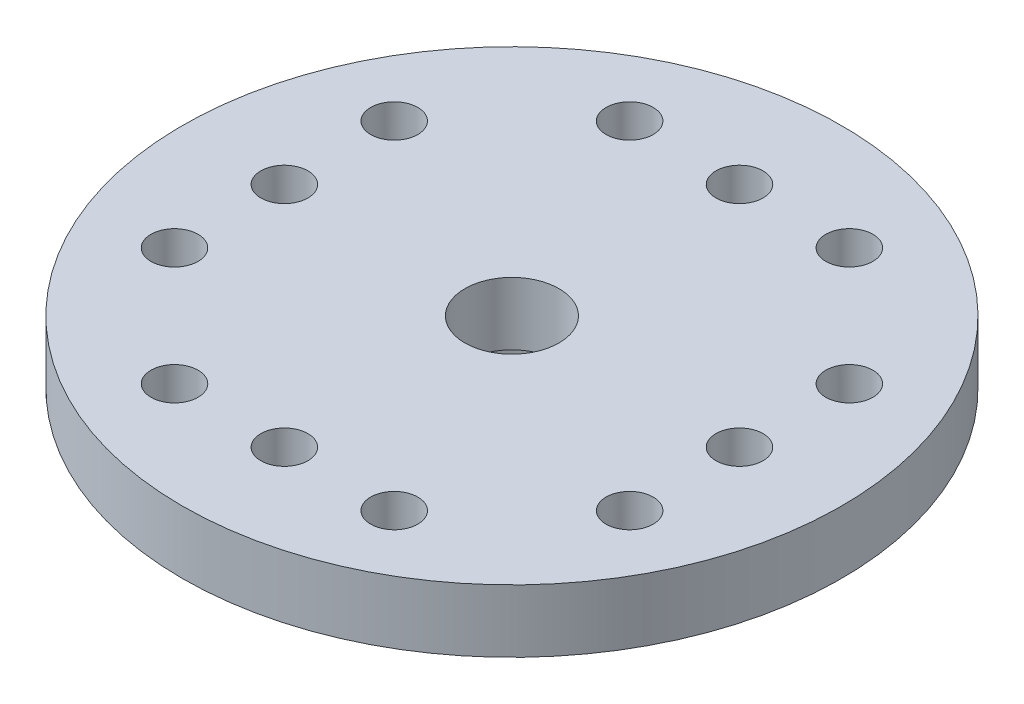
SolidWorks part; units mm, degrees
ref_plane "Front Plane" through (0, 0, 0) normal (0, 0, 1) x (1, 0, 0)
ref_plane "Top Plane" through (0, 0, 0) normal (0, 1, 0) x (1, 0, 0)
ref_plane "Right Plane" through (0, 0, 0) normal (1, 0, 0) x (0, 0, -1)
sketch "Sketch1" plane through (0, 0, 0) normal (0, 1, 0) x (1, 0, 0)
  circle A0 centre (0, 0) radius 10.5
  circle A1 centre (0, 0) radius 1.5
extrude "Boss-Extrude1" add sketch "Sketch1" against normal blind 2
sketch "Sketch2" plane through (0, -2, 0) normal (0, -1, 0) x (1, 0, 0)
  circle A0 centre (0, 0) radius 4.4
  circle A1 centre (0, 0) radius 3
extrude "Boss-Extrude2" add sketch "Sketch2" along normal blind 3.7
sketch "Sketch3" plane through (0, 0, 0) normal (0, 1, 0) x (1, 0, 0)
  line L0 (0, 0) -> (0, 7.25) construction
  line L1 (0, 0) -> (-5.3709, 5.3709) construction
  line L2 (0, 0) -> (5.3709, 5.3709) construction
  circle A0 centre (0, 7.25) radius 0.75
  circle A1 centre (3.5, 7.25) radius 0.75
  circle A2 centre (-3.5, 7.25) radius 0.75
  circle A3 centre (-7.25, 3.5) radius 0.75
  circle A4 centre (-7.25, -3.5) radius 0.75
  circle A5 centre (-7.25, 0) radius 0.75
  circle A6 centre (7.25, -3.5) radius 0.75
  circle A7 centre (7.25, 3.5) radius 0.75
  circle A8 centre (7.25, 0) radius 0.75
  circle A9 centre (0, -7.25) radius 0.75
  circle A10 centre (-3.5, -7.25) radius 0.75
  circle A11 centre (3.5, -7.25) radius 0.75
  dimension "D1" = 7
  dimension "D2" = 3.5
  dimension "D3" = 7.25
  dimension "D4" = 45
extrude "Cut-Extrude1" cut sketch "Sketch3" against normal blind 10
